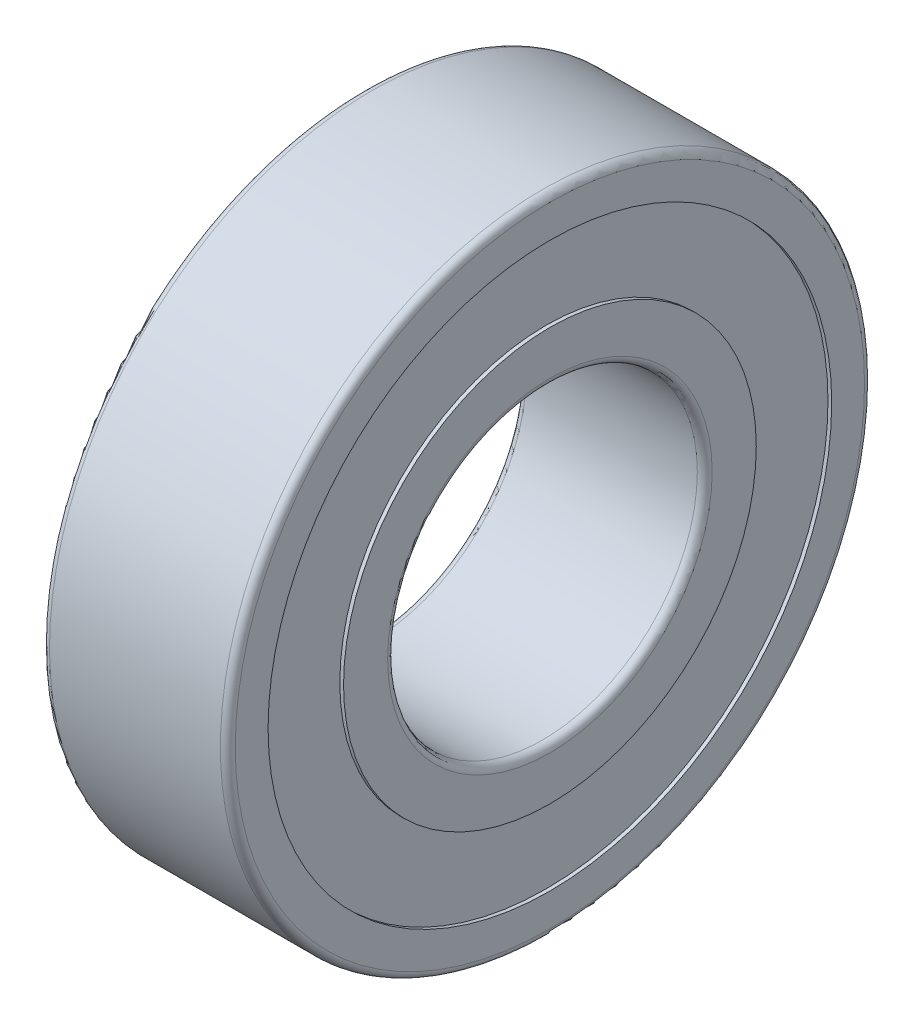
SolidWorks part; units mm, degrees
ref_plane "Alzado" through (0, 0, 0) normal (0, 0, 1) x (1, 0, 0)
ref_plane "Planta" through (0, 0, 0) normal (0, 1, 0) x (1, 0, 0)
ref_plane "Vista lateral" through (0, 0, 0) normal (1, 0, 0) x (0, 0, -1)
sketch "Croquis1" plane through (0, 0, 0) normal (0, 1, 0) x (1, 0, 0)
  line L0 (0, 0) -> (0, 26) construction
  line L1 (0, 26) -> (15, 26) construction
  line L2 (15, 0) -> (15, 12.5) construction
  line L3 (15, 12.5) -> (0, 12.5) construction
  line L4 (0, 26) -> (7.5, 26)
  line L6 (7.5, 12.5) -> (0, 12.5)
  line L8 (0, 0) -> (-27.5423, 0) construction
  line L9 (7.5, 12.5) -> (7.5, 26)
  line L10 (-7.5, 12.5) -> (-7.5, 26)
  line L11 (0, 26) -> (-7.5, 26)
  line L12 (-7.5, 12.5) -> (0, 12.5)
revolve "Revolución1" add sketch "Croquis1" angle 360 about L8
sketch "Croquis2" plane through (7.5, 0, 0) normal (1, 0, 0) x (0, 0, -1)
  line L0 (0, 12.5) -> (0, 15) construction
  line L1 (0, 22.75) -> (0, 26) construction
  line L2 (0, 0) -> (16.66, 0) construction
  line L3 (0, 0) -> (-22.75, 0) construction
  circle A1 centre (0, 0) radius 22.75
  circle A2 centre (0, 0) radius 12.5 construction
  circle A3 centre (0, 0) radius 26 construction
  circle A4 centre (0, 0) radius 16.66
extrude "Cortar-Extruir1" cut sketch "Croquis2" against normal blind 0.3
mirror "Simetría1" about plane through (0, 0, 0) normal (1, 0, 0) of "Cortar-Extruir1"
fillet "Redondeo1" radius 0.6 4 edges at (-7.5, 0, -26) (-7.5, 0, -12.5) (7.5, 0, -12.5) (7.5, 0, -26)
